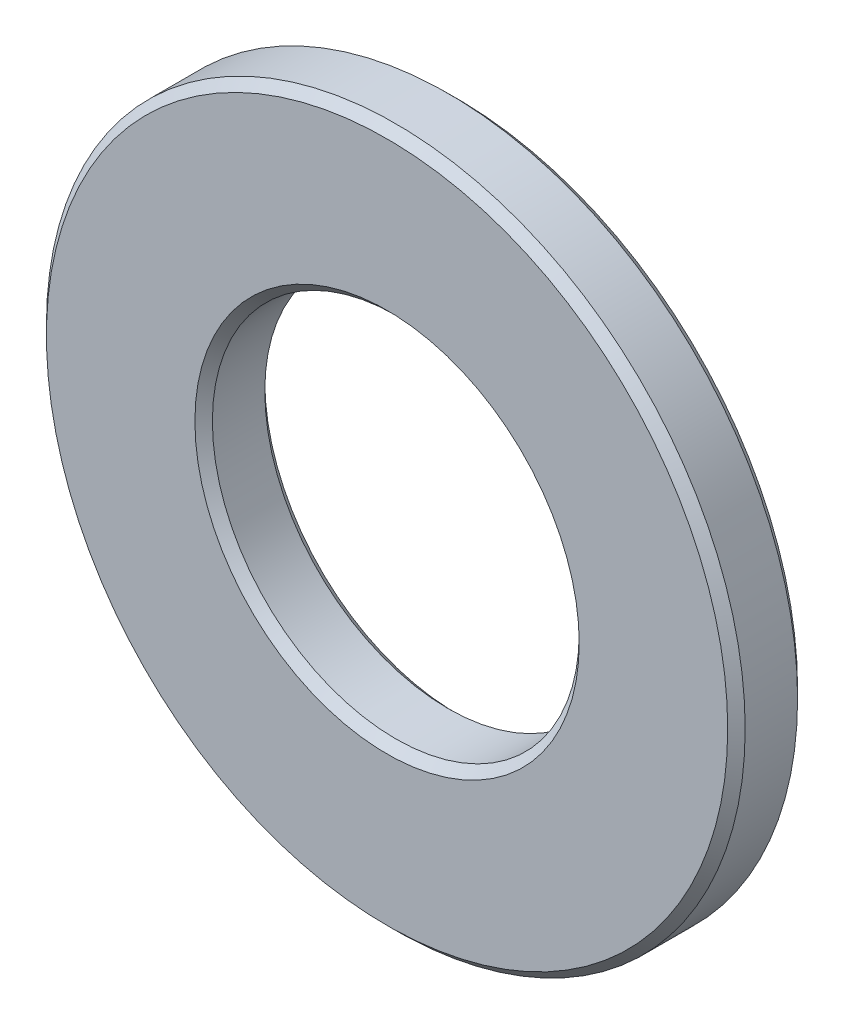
SolidWorks part; units mm, degrees
ref_plane "Front Plane" through (0, 0, 0) normal (0, 0, 1) x (1, 0, 0)
ref_plane "Top Plane" through (0, 0, 0) normal (0, 1, 0) x (1, 0, 0)
ref_plane "Right Plane" through (0, 0, 0) normal (1, 0, 0) x (0, 0, -1)
sketch "Sketch2" plane through (0, 0, 0) normal (0, 0, 1) x (1, 0, 0)
  circle A0 centre (0, 0) radius 4.2
  circle A1 centre (0, 0) radius 8
  dimension "D1" = 8.4
  dimension "D2" = 16
extrude "Boss-Extrude1" add sketch "Sketch2" along normal mid plane 1.6
chamfer "Chamfer1" distance 0.2 angle 45 1 edges at (8, 0, 0.8)
chamfer "Chamfer2" distance 0.2 angle 45 1 edges at (8, 0, -0.8)
chamfer "Chamfer3" distance 0.2 angle 45 1 edges at (4.2, 0, -0.8)
chamfer "Chamfer4" distance 0.2 angle 45 1 edges at (4.2, 0, 0.8)
